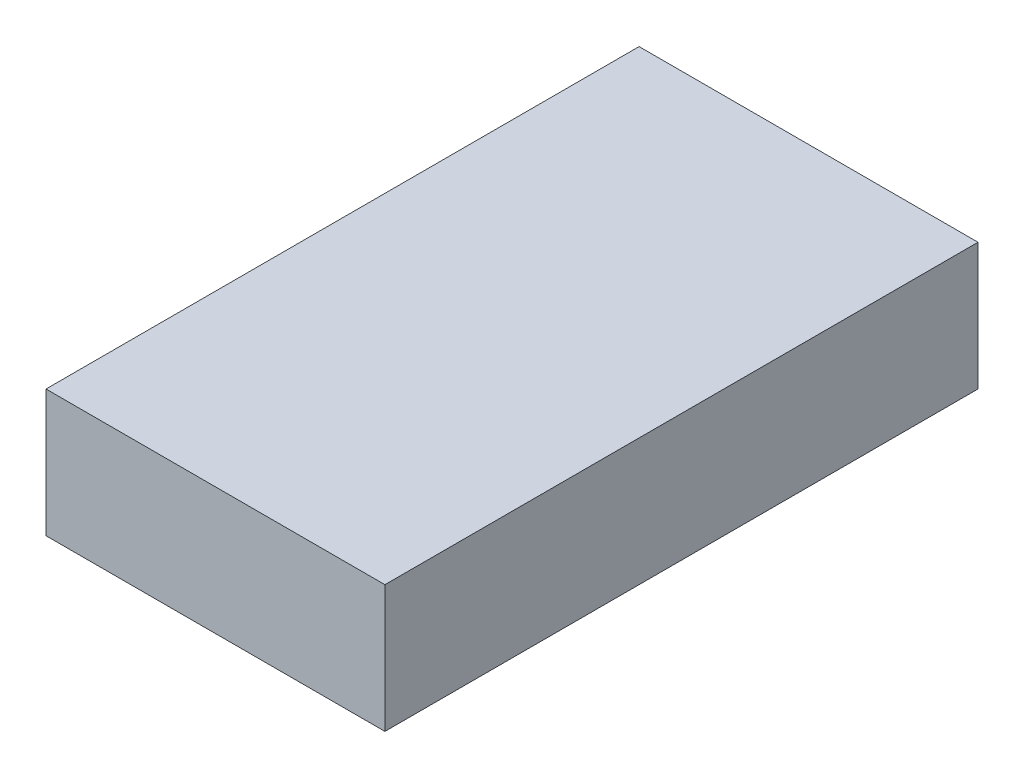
SolidWorks part; units mm, degrees
ref_plane "Front" through (0, 0, 0) normal (0, 0, 1) x (1, 0, 0)
ref_plane "Top" through (0, 0, 0) normal (0, 1, 0) x (1, 0, 0)
ref_plane "Right" through (0, 0, 0) normal (1, 0, 0) x (0, 0, -1)
sketch "Side guide" plane through (0, 0, 0) normal (0, 1, 0) x (1, 0, 0)
  line L0 (0, 0) -> (0, 88.9) construction
  line L1 (-25.4, 0) -> (-25.4, 10.16)
  line L2 (-25.4, 78.74) -> (-25.4, 88.9)
  arc A0 (-25.4, 10.16) -> (-28.5995, 22.5009) centre (-50.8, 10.16) ccw
  arc A1 (-28.5995, 22.5009) -> (-28.5995, 66.3991) centre (10.8857, 44.45) cw
  arc A2 (-28.5995, 66.3991) -> (-25.4, 78.74) centre (-50.8, 78.74) ccw
  point P12 (0, 44.45)
  dimension "D3" = 25.4
  dimension "D4" = 68.58
  dimension "D1" = 25.4
  dimension "D2" = 88.9
  dimension "D5" = 10.16
ref_plane "Plane1" through (0, 19.05, 0) normal (0, 1, 0) x (-1, 0, 0)
sketch "Upper guide/Path" plane through (0, 19.05, 0) normal (0, 1, 0) x (-1, 0, 0)
  line L0 (25.4, 0) -> (25.4, -10.16) construction
  line L1 (25.4, 0) -> (25.4, -88.9)
sketch "Profile" plane through (0, 0, 0) normal (0, 0, 1) x (1, 0, 0)
  line L0 (0, 0.7538) -> (0, 19.05) construction
  line L1 (-25.4, 19.05) -> (25.4, 19.05)
  line L2 (-25.4, 19.05) -> (-25.4, 0)
  line L3 (-25.4, 0) -> (25.4, 0)
  line L4 (25.4, 19.05) -> (25.4, 0)
sweep "Sweep4" add profiles "Profile" path "Upper guide/Path"
